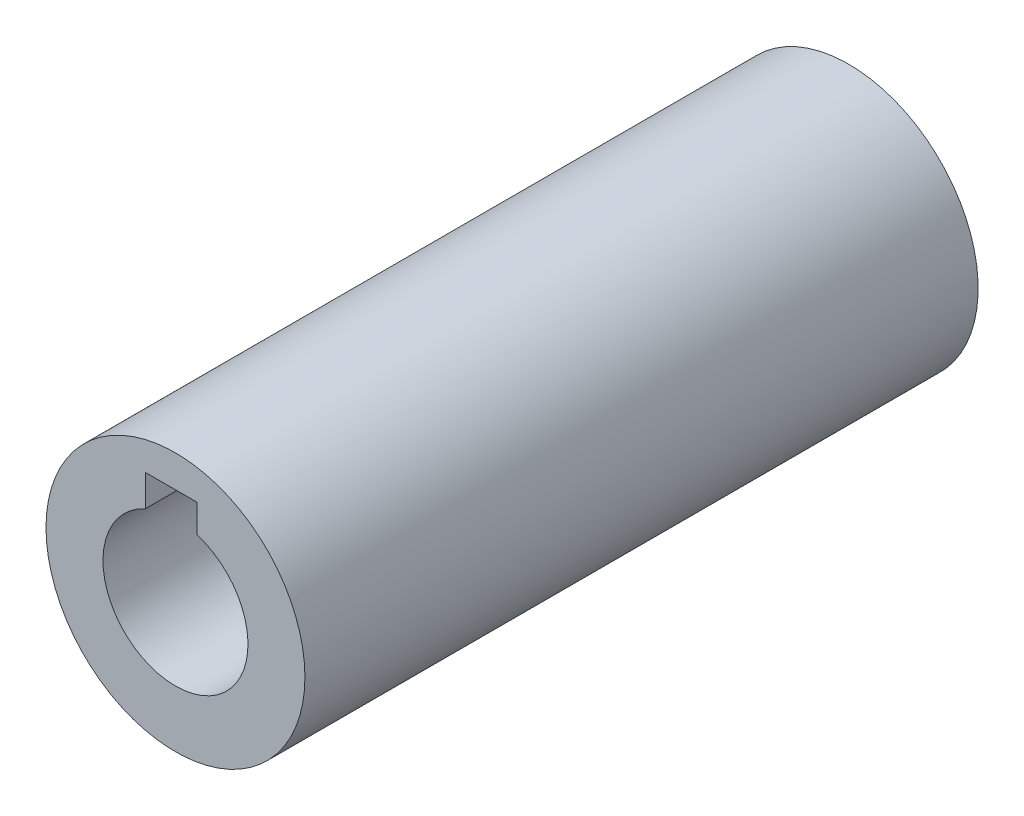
SolidWorks part; units mm, degrees
ref_plane "Front Plane" through (0, 0, 0) normal (0, 0, 1) x (1, 0, 0)
ref_plane "Top Plane" through (0, 0, 0) normal (0, 1, 0) x (1, 0, 0)
ref_plane "Right Plane" through (0, 0, 0) normal (1, 0, 0) x (0, 0, -1)
sketch "Sketch1" plane through (0, 0, 0) normal (0, 0, 1) x (1, 0, 0)
  line L2 (-2.9167, 6.3634) -> (-2.9167, 9.4091)
  line L3 (-2.9167, 9.4091) -> (2.0833, 9.4091)
  line L4 (2.0833, 6.6828) -> (2.0833, 9.4091)
  arc A0 (-2.9167, 6.3634) -> (2.0833, 6.6828) centre (0, 0) ccw
  circle A1 centre (0, 0) radius 12.5
  point P3 (0, 7)
  dimension "D1" = 14
  dimension "D3" = 25
  dimension "D2" = 5
extrude "Boss-Extrude1" add sketch "Sketch1" along normal blind 30
sketch "Sketch3" plane through (0, 0, 0) normal (0, 0, -1) x (-1, 0, 0)
  line L2 (-1.25, 5.8683) -> (-1.25, 7.8557)
  line L3 (-1.25, 7.8557) -> (1.25, 7.8557)
  line L4 (1.25, 5.8683) -> (1.25, 7.8557)
  arc A0 (-1.25, 5.8683) -> (1.25, 5.8683) centre (0, 0) ccw
  circle A1 centre (0, 0) radius 12.5
  point P1 (0, 7.8557)
  point P3 (0, 6)
  dimension "D1" = 6
  dimension "D3" = 25
  dimension "D2" = 2.5
sketch "Sketch4" plane through (0, 0, 0) normal (0, 0, -1) x (-1, 0, 0)
  circle A0 centre (0, 0) radius 12.5 construction
  circle A1 centre (0, 0) radius 12.5
extrude "Boss-Extrude2" add sketch "Sketch4" along normal blind 5
sketch "Sketch5" plane through (0, 0, -5) normal (0, 0, -1) x (-1, 0, 0)
  line L0 (1.25, 5.8683) -> (1.25, 7.8557) construction
  line L1 (-1.25, 5.8683) -> (-1.25, 7.8557) construction
  line L2 (-1.25, 7.8557) -> (1.25, 7.8557) construction
  line L3 (1.25, 5.8683) -> (1.25, 7.8557)
  line L4 (-1.25, 7.8557) -> (1.25, 7.8557)
  line L5 (-1.25, 5.8683) -> (-1.25, 7.8557)
  arc A0 (-1.25, 5.8683) -> (1.25, 5.8683) centre (0, 0) ccw construction
  circle A1 centre (0, 0) radius 12.5 construction
  circle A2 centre (0, 0) radius 12.5
  circle A3 centre (0, 0) radius 12.5
  circle A4 centre (0, 0) radius 12.5
  arc A5 (-1.25, 5.8683) -> (1.25, 5.8683) centre (0, 0) ccw
  circle A6 centre (0, 0) radius 12.5
  dimension "D2" = 25
  dimension "D1" = 0
extrude "Boss-Extrude3" add sketch "Sketch5" along normal blind 30 contours A5 L5 L4 L3 M2
